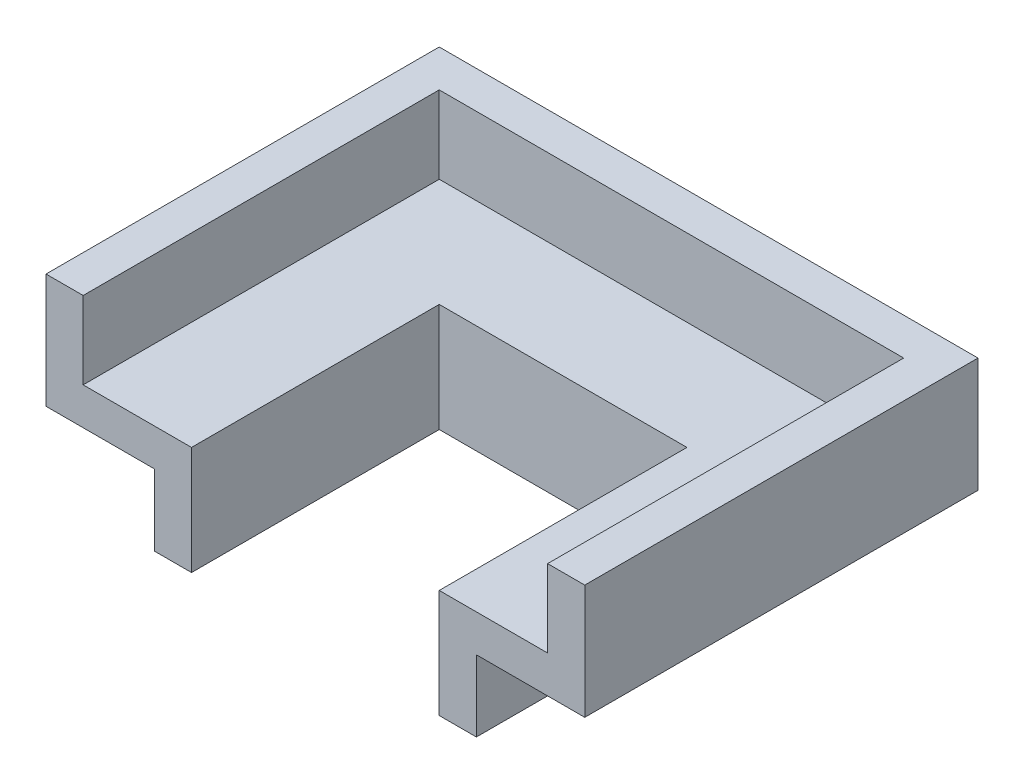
SolidWorks part; units mm, degrees
ref_plane "Front Plane" through (0, 0, 0) normal (0, 0, 1) x (1, 0, 0)
ref_plane "Top Plane" through (0, 0, 0) normal (0, 1, 0) x (1, 0, 0)
ref_plane "Right Plane" through (0, 0, 0) normal (1, 0, 0) x (0, 0, -1)
sketch "Sketch1" plane through (0, 0, 0) normal (0, 1, 0) x (1, 0, 0)
  line L0 (0, 0) -> (0, 80) construction
  line L1 (-40, 80) -> (40, 80)
  line L2 (40, 80) -> (40, 0)
  line L3 (-40, 80) -> (-40, 0)
  dimension "D1" = 80
  dimension "D2" = 80
sketch "Sketch2" plane through (0, 0, 0) normal (0, 0, 1) x (1, 0, 0)
  line L0 (40, 0) -> (40, 35)
  line L1 (40, 35) -> (75, 35)
  line L2 (75, 35) -> (75, 60)
  line L3 (52, 0) -> (52, 23)
  line L4 (52, 23) -> (87, 23)
  line L5 (87, 23) -> (87, 60)
  line L6 (75, 60) -> (87, 60)
  line L7 (40, 0) -> (52, 0)
  line L8 (0, 0) -> (0, 29.8868) construction
  dimension "D2" = 35
  dimension "D3" = 60
  dimension "D4" = 80
  dimension "D5" = 150
  dimension "D1" = 12
sweep "Sweep1" add profiles "Sketch2" path "Sketch1"
